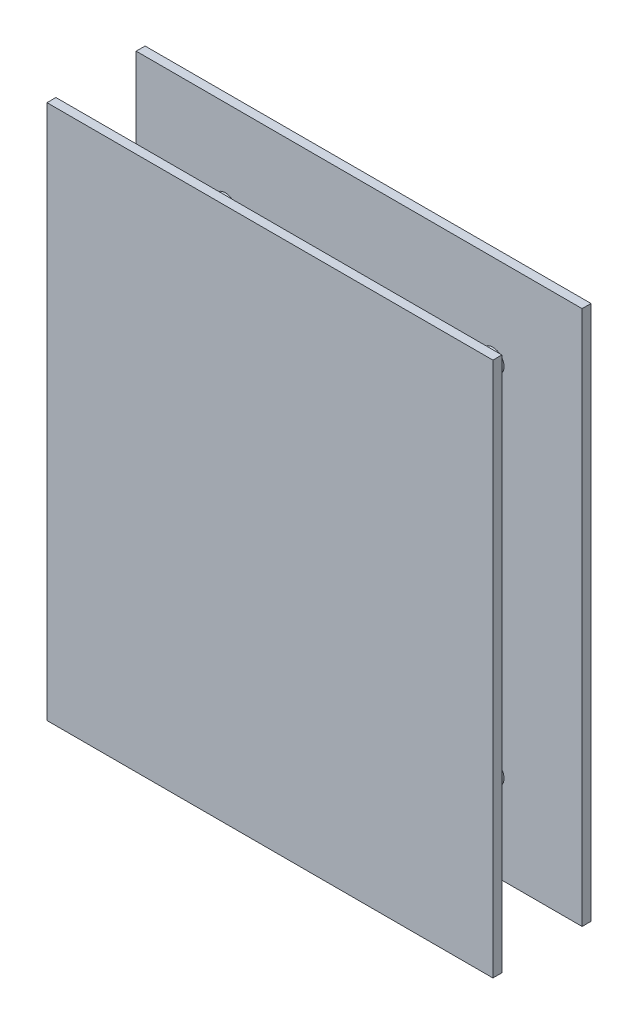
SolidWorks part; units mm, degrees
ref_plane "Plan de face" through (0, 0, 0) normal (0, 0, 1) x (1, 0, 0)
ref_plane "Plan de dessus" through (0, 0, 0) normal (0, 1, 0) x (1, 0, 0)
ref_plane "Plan de droite" through (0, 0, 0) normal (1, 0, 0) x (0, 0, -1)
sketch "Esquisse1" plane through (0, 0, 0) normal (0, 0, 1) x (1, 0, 0)
  line L1 (0, 0) -> (100, 0)
  line L2 (0, 0) -> (0, 120)
  line L3 (0, 120) -> (100, 120)
  line L4 (100, 0) -> (100, 120)
  dimension "D1" = 100
  dimension "D2" = 120
extrude "Boss.-Extru.1" add sketch "Esquisse1" along normal blind 2
sketch "Esquisse2" plane through (0, 0, 2) normal (0, 0, 1) x (1, 0, 0)
  line L0 (0, 0) -> (100, 0) construction
  line L1 (0, 120) -> (0, 0) construction
  line L2 (100, 0) -> (100, 120) construction
  line L3 (20, 20) -> (80, 20) construction
  line L4 (20, 20) -> (20, 100) construction
  line L5 (20, 100) -> (80, 100) construction
  line L6 (80, 20) -> (80, 100) construction
  line L7 (100, 120) -> (0, 120) construction
  circle A0 centre (20, 20) radius 2.5
  circle A1 centre (20, 100) radius 2.5
  circle A2 centre (80, 100) radius 2.5
  circle A3 centre (80, 20) radius 2.5
  dimension "D1" = 5
  dimension "D2" = 20
  dimension "D3" = 20
  dimension "D4" = 20
  dimension "D5" = 2
extrude "Boss.-Extru.2" add sketch "Esquisse2" along normal blind 18
sketch "Esquisse4" plane through (0, 0, 0) normal (0, 0, -1) x (-1, 0, 0)
  line L0 (0, 120) -> (0, 0) construction
  line L1 (-75, 72.5) -> (-25, 72.5) construction
  line L2 (-75, 72.5) -> (-75, 47.5) construction
  line L3 (-75, 47.5) -> (-25, 47.5) construction
  line L4 (-25, 72.5) -> (-25, 47.5) construction
  line L5 (0, 0) -> (-100, 0) construction
  circle A0 centre (-75, 72.5) radius 1.75
  circle A1 centre (-75, 47.5) radius 1.75
  circle A2 centre (-25, 47.5) radius 1.75
  circle A3 centre (-25, 72.5) radius 1.75
  dimension "D5" = 3.5
  dimension "D1" = 50
  dimension "D2" = 25
  dimension "D3" = 25
  dimension "D4" = 47.5
sketch "Esquisse5" plane through (0, 0, 20) normal (0, 0, 1) x (1, 0, 0)
  line L0 (100, 0) -> (100, 120) construction
  line L1 (0, 120) -> (100, 120)
  line L2 (0, 120) -> (0, 0)
  line L3 (0, 0) -> (100, 0)
  line L4 (100, 120) -> (100, 0)
extrude "Boss.-Extru.3" add sketch "Esquisse5" along normal blind 2
extrude "Enlèv. mat.-Extru.1" cut sketch "Esquisse4" against normal blind 10
